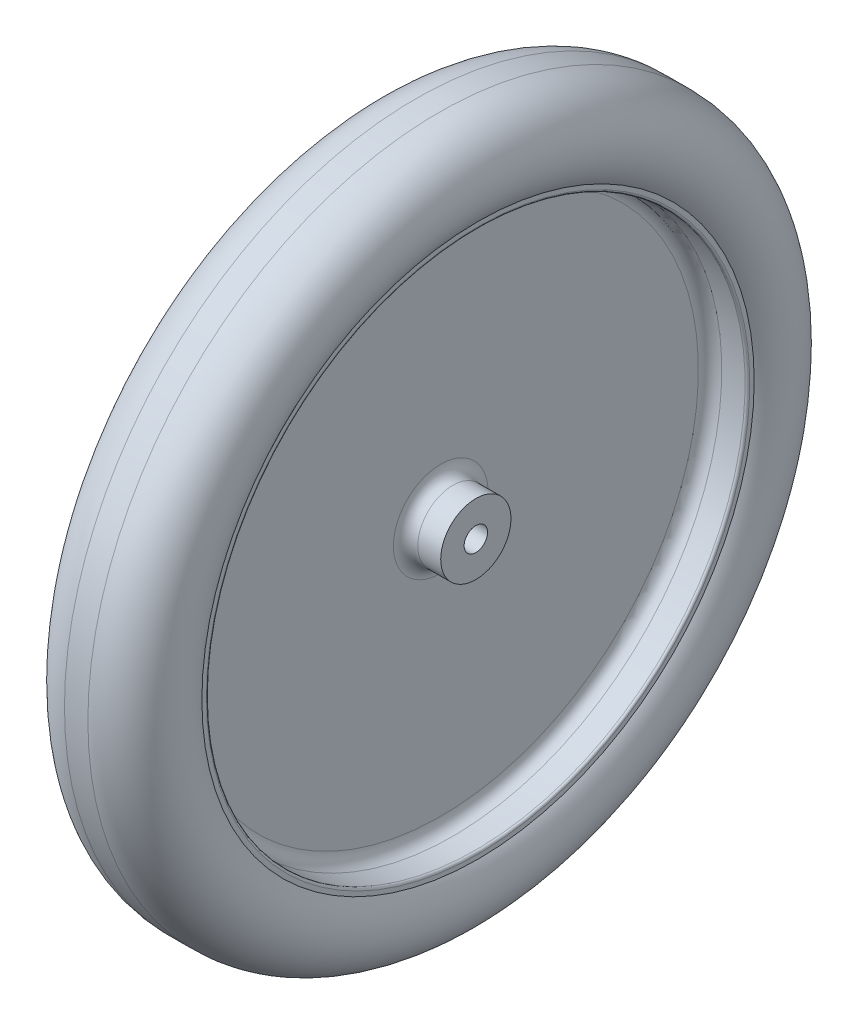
SolidWorks part; units mm, degrees
ref_plane "Plan de face" through (0, 0, 0) normal (0, 0, 1) x (1, 0, 0)
ref_plane "Plan de dessus" through (0, 0, 0) normal (0, 1, 0) x (1, 0, 0)
ref_plane "Plan de droite" through (0, 0, 0) normal (1, 0, 0) x (0, 0, -1)
sketch "Esquisse2" plane through (0, 0, 0) normal (0, 0, 1) x (1, 0, 0)
  line L0 (-36.2685, 0) -> (31.6261, 0) construction
  line L1 (-9.9547, 30) -> (-28.6438, 30)
  line L2 (31.3562, 230.0794) -> (51.2397, 230.0794)
  line L3 (1.3562, 41.3109) -> (1.3562, 220.0794)
  line L4 (0, 300) -> (20, 300)
  line L5 (21.3562, 40.4006) -> (21.3562, 220.0794)
  line L6 (51.3562, 10) -> (-28.6438, 10)
  line L7 (51.3562, 10) -> (51.3562, 30)
  line L8 (51.3562, 30) -> (31.7569, 30)
  line L9 (-28.6438, 10) -> (-28.6438, 30)
  line L10 (53.2397, 232.0794) -> (53.2397, 235.8684)
  line L11 (-8.6438, 230.0794) -> (-28.8425, 230.0794)
  line L12 (-30.8425, 232.0794) -> (-30.8425, 236.2903)
  line L13 (11.3562, 10) -> (11.3562, 314.2128) construction
  arc A0 (0, 300) -> (-30.8425, 236.2903) centre (1.3562, 260.023) ccw
  arc A1 (20, 300) -> (53.2397, 235.8684) centre (21.3562, 260.023) cw
  arc A2 (31.3562, 230.0794) -> (21.3562, 220.0794) centre (31.3562, 220.0794) ccw
  arc A3 (-8.6438, 230.0794) -> (1.3562, 220.0794) centre (-8.6438, 220.0794) cw
  arc A4 (1.3562, 41.3109) -> (-9.9547, 30) centre (-9.9547, 41.3109) cw
  arc A5 (21.3562, 40.4006) -> (31.7569, 30) centre (31.7569, 40.4006) ccw
  arc A6 (51.2397, 230.0794) -> (53.2397, 232.0794) centre (51.2397, 232.0794) ccw
  arc A7 (-28.8425, 230.0794) -> (-30.8425, 232.0794) centre (-28.8425, 232.0794) cw
  point P18 (21.3562, 230.0794)
  point P21 (1.3562, 30)
  dimension "D5" = 10
  dimension "D6" = 2
  dimension "D7" = 40
  dimension "D8" = 40
  dimension "D1" = 10
  dimension "D2" = 80
  dimension "D3" = 300
  dimension "D4" = 20
  dimension "D9" = 10
  dimension "D10" = 20
  dimension "D11" = 20
revolve "Révolution1" add sketch "Esquisse2" angle 360 about L0
